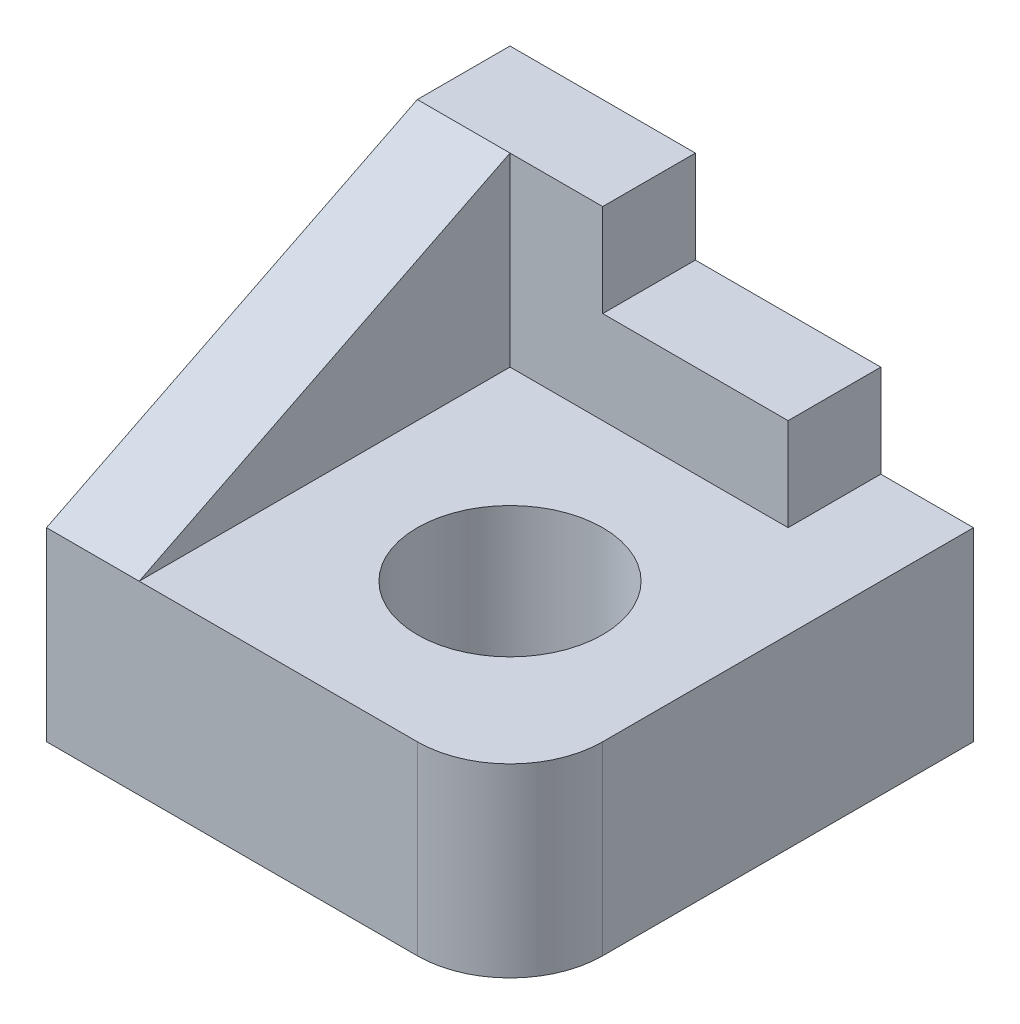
SolidWorks part; units mm, degrees
ref_plane "Front Plane" through (0, 0, 0) normal (0, 0, 1) x (1, 0, 0)
ref_plane "Top Plane" through (0, 0, 0) normal (0, 1, 0) x (1, 0, 0)
ref_plane "Right Plane" through (0, 0, 0) normal (1, 0, 0) x (0, 0, -1)
sketch "Sketch1" plane through (0, 0, 0) normal (0, 1, 0) x (1, 0, 0)
  line L1 (0, 0) -> (50, 0)
  line L2 (0, 0) -> (0, -50)
  line L3 (0, -50) -> (50, -50)
  line L4 (50, 0) -> (50, -50)
  dimension "D1" = 50
  dimension "D2" = 50
extrude "Extrude1" add sketch "Sketch1" along normal blind 20
fillet "Fillet1" radius 10 1 edges at (50, 10, 50)
sketch "Sketch2" plane through (0, 20, 0) normal (0, 1, 0) x (1, 0, 0)
  line L0 (50, -40) -> (50, 0) construction
  line L1 (0, -50) -> (40, -50) construction
  circle A0 centre (30, -30) radius 10
  dimension "D1" = 20
  dimension "D2" = 20
  dimension "D3" = 20
extrude "Extrude2" cut sketch "Sketch2" against normal blind 20
sketch "Sketch3" plane through (0, 0, 0) normal (0, 0, -1) x (-1, 0, 0)
  line L0 (0, 20) -> (0, 40)
  line L1 (0, 40) -> (-20, 40)
  line L2 (-20, 40) -> (-20, 30)
  line L3 (-20, 30) -> (-40, 30)
  line L4 (-40, 30) -> (-40, 20)
  line L5 (-50, 20) -> (0, 20) construction
  line L6 (-40, 20) -> (0, 20)
  line L7 (-50, 0) -> (0, 0) construction
  dimension "D1" = 10
  dimension "D2" = 20
  dimension "D3" = 20
  dimension "D4" = 40
extrude "Extrude3" add sketch "Sketch3" against normal blind 10
sketch "Sketch4" plane through (0, 0, 0) normal (1, 0, 0) x (0, 0, -1)
  line L0 (-10, 40) -> (-50, 20)
rib "Rib2" sketch "Sketch4" sketch "Sketch4" thickness 10 parameters "D1"=10
